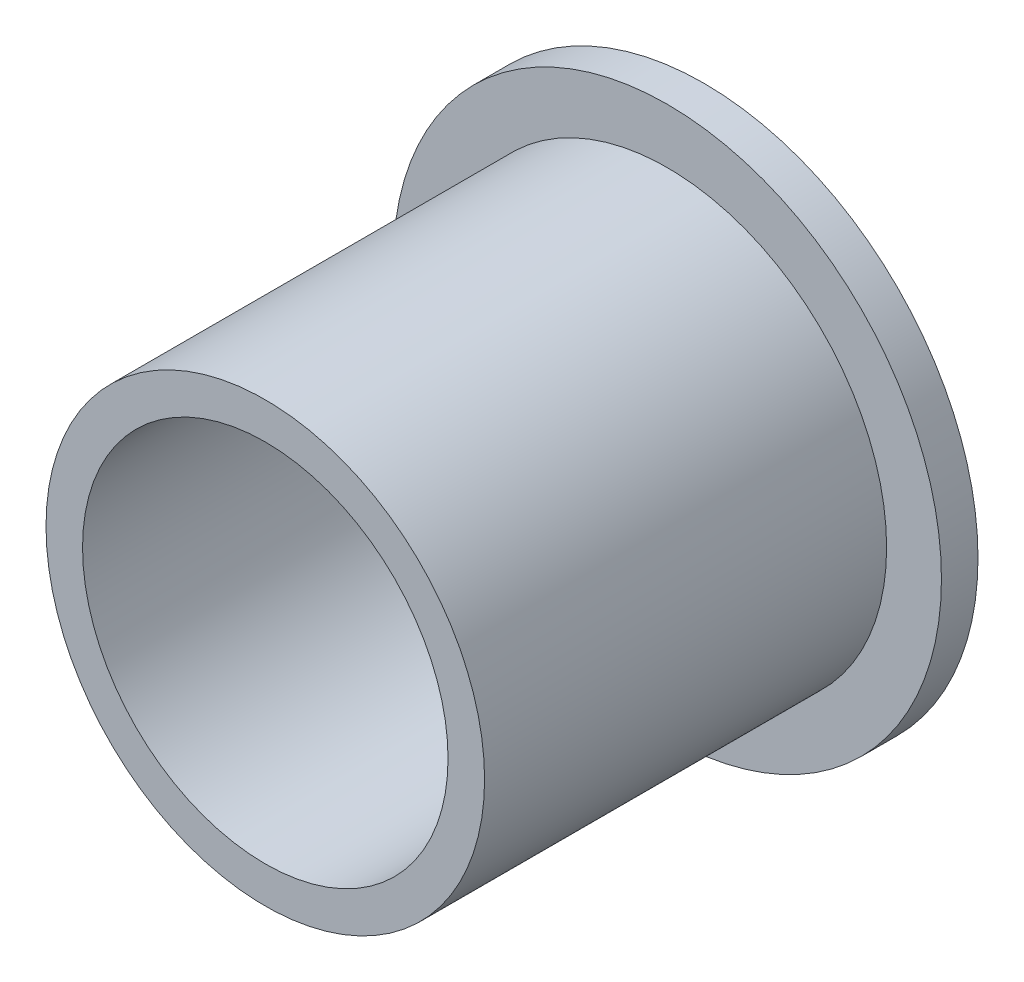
SolidWorks part; units mm, degrees
ref_plane "Ebene vorne" through (0, 0, 0) normal (0, 0, 1) x (1, 0, 0)
ref_plane "Ebene oben" through (0, 0, 0) normal (0, 1, 0) x (1, 0, 0)
ref_plane "Ebene rechts" through (0, 0, 0) normal (1, 0, 0) x (0, 0, -1)
sketch "Skizze1" plane through (0, 0, 0) normal (1, 0, 0) x (0, 0, -1)
  line L0 (0, 5) -> (12, 5)
  line L1 (12, 5) -> (12, 7.5)
  line L2 (12, 7.5) -> (11, 7.5)
  line L3 (11, 7.5) -> (11, 6)
  line L4 (11, 6) -> (0, 6)
  line L5 (0, 6) -> (0, 5)
  line L6 (0, 0) -> (8.9871, 0) construction
  dimension "D1" = 5
  dimension "D2" = 6
  dimension "D3" = 12
  dimension "D4" = 1
  dimension "D5" = 7.5
revolve "Rotation1" add sketch "Skizze1" angle 360 about L6
